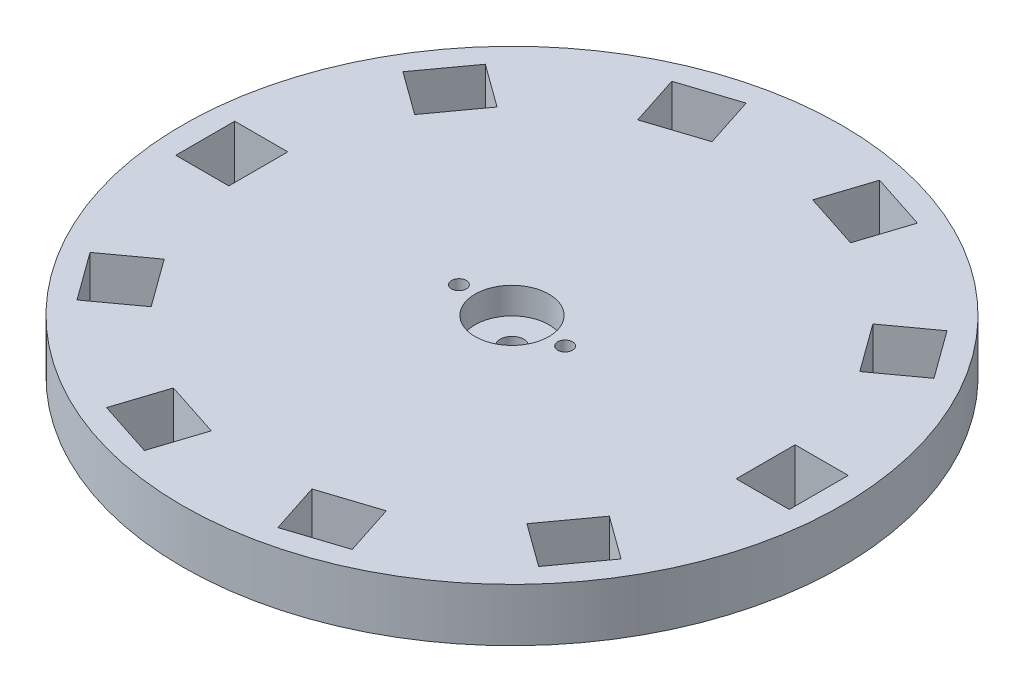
SolidWorks part; units mm, degrees
ref_plane "Front Plane" through (0, 0, 0) normal (0, 0, 1) x (1, 0, 0)
ref_plane "Top Plane" through (0, 0, 0) normal (0, 1, 0) x (1, 0, 0)
ref_plane "Right Plane" through (0, 0, 0) normal (1, 0, 0) x (0, 0, -1)
sketch "Sketch1" plane through (0, 0, 0) normal (0, 1, 0) x (1, 0, 0)
  circle A0 centre (0, 0) radius 111.73
  dimension "D1" = 223.46
extrude "Boss-Extrude1" add sketch "Sketch1" along normal blind 18
sketch "Sketch2" plane through (0, 18, 0) normal (0, 1, 0) x (1, 0, 0)
  circle A0 centre (0, 0) radius 4
  dimension "D1" = 8
extrude "Cut-Extrude1" cut sketch "Sketch2" against normal through all both and the other way through all
sketch "Sketch3" plane through (0, 18, 0) normal (0, 1, 0) x (1, 0, 0)
  circle A0 centre (0, 0) radius 12.5
  dimension "D1" = 25
extrude "Cut-Extrude2" cut sketch "Sketch3" against normal blind 9
sketch "Sketch4" plane through (0, 18, 0) normal (0, 1, 0) x (1, 0, 0)
  line L0 (15.5, 0) -> (-15.5, 0) construction
  line L1 (-15.5, 0) -> (15.5, 0) construction
  line L2 (0, 0) -> (0, -27.2184) construction
  circle A0 centre (18, 0) radius 2.5
  circle A1 centre (-18, 0) radius 2.5
  point P6 (0, 0)
  dimension "D2" = 5
  dimension "D1" = 31
extrude "Cut-Extrude3" cut sketch "Sketch4" against normal through all
sketch "Sketch5" plane through (0, 0, 0) normal (0, -1, 0) x (1, 0, 0)
  line L0 (0, 0) -> (95, 0) construction
  line L1 (104, 20) -> (86, 20) construction
  line L2 (104, 20) -> (104, -20) construction
  line L3 (104, -20) -> (86, -20) construction
  line L4 (86, 20) -> (86, -20) construction
  line L5 (104, 20) -> (86, -20) construction
  line L6 (104, -20) -> (86, 20) construction
  line L7 (90.0156, -53.0395) -> (75.4533, -42.4594)
  line L8 (104, 10) -> (86, 10)
  line L9 (104, 10) -> (104, -10)
  line L10 (104, -10) -> (86, -10)
  line L11 (86, 10) -> (86, -10)
  line L12 (104, 10) -> (86, -10) construction
  line L13 (104, -10) -> (86, 10) construction
  line L14 (90.0156, -53.0395) -> (78.2599, -69.2198)
  line L15 (78.2599, -69.2198) -> (63.6976, -58.6397)
  line L16 (75.4533, -42.4594) -> (63.6976, -58.6397)
  line L17 (95.8935, -44.9493) -> (81.3312, -34.3692) construction
  line L18 (95.8935, -44.9493) -> (72.3821, -77.31) construction
  line L19 (72.3821, -77.31) -> (57.8198, -66.7299) construction
  line L20 (81.3312, -34.3692) -> (57.8198, -66.7299) construction
  line L21 (95.8935, -44.9493) -> (57.8198, -66.7299) construction
  line L22 (72.3821, -77.31) -> (81.3312, -34.3692) construction
  line L23 (90.0156, -53.0395) -> (63.6976, -58.6397) construction
  line L24 (78.2599, -69.2198) -> (75.4533, -42.4594) construction
  line L25 (41.6483, -95.8197) -> (36.086, -78.7007)
  line L26 (41.6483, -95.8197) -> (22.6272, -102)
  line L27 (22.6272, -102) -> (17.0649, -84.881)
  line L28 (36.086, -78.7007) -> (17.0649, -84.881)
  line L29 (51.1589, -92.7295) -> (45.5966, -75.6105) construction
  line L30 (51.1589, -92.7295) -> (13.1166, -105.0902) construction
  line L31 (13.1166, -105.0902) -> (7.5543, -87.9712) construction
  line L32 (45.5966, -75.6105) -> (7.5543, -87.9712) construction
  line L33 (51.1589, -92.7295) -> (7.5543, -87.9712) construction
  line L34 (13.1166, -105.0902) -> (45.5966, -75.6105) construction
  line L35 (41.6483, -95.8197) -> (17.0649, -84.881) construction
  line L36 (22.6272, -102) -> (36.086, -78.7007) construction
  line L37 (-22.6272, -102) -> (-17.0649, -84.881)
  line L38 (-22.6272, -102) -> (-41.6483, -95.8197)
  line L39 (-41.6483, -95.8197) -> (-36.086, -78.7007)
  line L40 (-17.0649, -84.881) -> (-36.086, -78.7007)
  line L41 (-13.1166, -105.0902) -> (-7.5543, -87.9712) construction
  line L42 (-13.1166, -105.0902) -> (-51.1589, -92.7295) construction
  line L43 (-51.1589, -92.7295) -> (-45.5966, -75.6105) construction
  line L44 (-7.5543, -87.9712) -> (-45.5966, -75.6105) construction
  line L45 (-13.1166, -105.0902) -> (-45.5966, -75.6105) construction
  line L46 (-51.1589, -92.7295) -> (-7.5543, -87.9712) construction
  line L47 (-22.6272, -102) -> (-36.086, -78.7007) construction
  line L48 (-41.6483, -95.8197) -> (-17.0649, -84.881) construction
  line L49 (-78.2599, -69.2198) -> (-63.6976, -58.6397)
  line L50 (-78.2599, -69.2198) -> (-90.0156, -53.0395)
  line L51 (-90.0156, -53.0395) -> (-75.4533, -42.4594)
  line L52 (-63.6976, -58.6397) -> (-75.4533, -42.4594)
  line L53 (-72.3821, -77.31) -> (-57.8198, -66.7299) construction
  line L54 (-72.3821, -77.31) -> (-95.8935, -44.9493) construction
  line L55 (-95.8935, -44.9493) -> (-81.3312, -34.3692) construction
  line L56 (-57.8198, -66.7299) -> (-81.3312, -34.3692) construction
  line L57 (-72.3821, -77.31) -> (-81.3312, -34.3692) construction
  line L58 (-95.8935, -44.9493) -> (-57.8198, -66.7299) construction
  line L59 (-78.2599, -69.2198) -> (-75.4533, -42.4594) construction
  line L60 (-90.0156, -53.0395) -> (-63.6976, -58.6397) construction
  line L61 (-104, -10) -> (-86, -10)
  line L62 (-104, -10) -> (-104, 10)
  line L63 (-104, 10) -> (-86, 10)
  line L64 (-86, -10) -> (-86, 10)
  line L65 (-104, -20) -> (-86, -20) construction
  line L66 (-104, -20) -> (-104, 20) construction
  line L67 (-104, 20) -> (-86, 20) construction
  line L68 (-86, -20) -> (-86, 20) construction
  line L69 (-104, -20) -> (-86, 20) construction
  line L70 (-104, 20) -> (-86, -20) construction
  line L71 (-104, -10) -> (-86, 10) construction
  line L72 (-104, 10) -> (-86, -10) construction
  line L73 (-90.0156, 53.0395) -> (-75.4533, 42.4594)
  line L74 (-90.0156, 53.0395) -> (-78.2599, 69.2198)
  line L75 (-78.2599, 69.2198) -> (-63.6976, 58.6397)
  line L76 (-75.4533, 42.4594) -> (-63.6976, 58.6397)
  line L77 (-95.8935, 44.9493) -> (-81.3312, 34.3692) construction
  line L78 (-95.8935, 44.9493) -> (-72.3821, 77.31) construction
  line L79 (-72.3821, 77.31) -> (-57.8198, 66.7299) construction
  line L80 (-81.3312, 34.3692) -> (-57.8198, 66.7299) construction
  line L81 (-95.8935, 44.9493) -> (-57.8198, 66.7299) construction
  line L82 (-72.3821, 77.31) -> (-81.3312, 34.3692) construction
  line L83 (-90.0156, 53.0395) -> (-63.6976, 58.6397) construction
  line L84 (-78.2599, 69.2198) -> (-75.4533, 42.4594) construction
  line L85 (-41.6483, 95.8197) -> (-36.086, 78.7007)
  line L86 (-41.6483, 95.8197) -> (-22.6272, 102)
  line L87 (-22.6272, 102) -> (-17.0649, 84.881)
  line L88 (-36.086, 78.7007) -> (-17.0649, 84.881)
  line L89 (-51.1589, 92.7295) -> (-45.5966, 75.6105) construction
  line L90 (-51.1589, 92.7295) -> (-13.1166, 105.0902) construction
  line L91 (-13.1166, 105.0902) -> (-7.5543, 87.9712) construction
  line L92 (-45.5966, 75.6105) -> (-7.5543, 87.9712) construction
  line L93 (-51.1589, 92.7295) -> (-7.5543, 87.9712) construction
  line L94 (-13.1166, 105.0902) -> (-45.5966, 75.6105) construction
  line L95 (-41.6483, 95.8197) -> (-17.0649, 84.881) construction
  line L96 (-22.6272, 102) -> (-36.086, 78.7007) construction
  line L97 (22.6272, 102) -> (17.0649, 84.881)
  line L98 (22.6272, 102) -> (41.6483, 95.8197)
  line L99 (41.6483, 95.8197) -> (36.086, 78.7007)
  line L100 (17.0649, 84.881) -> (36.086, 78.7007)
  line L101 (13.1166, 105.0902) -> (7.5543, 87.9712) construction
  line L102 (13.1166, 105.0902) -> (51.1589, 92.7295) construction
  line L103 (51.1589, 92.7295) -> (45.5966, 75.6105) construction
  line L104 (7.5543, 87.9712) -> (45.5966, 75.6105) construction
  line L105 (13.1166, 105.0902) -> (45.5966, 75.6105) construction
  line L106 (51.1589, 92.7295) -> (7.5543, 87.9712) construction
  line L107 (22.6272, 102) -> (36.086, 78.7007) construction
  line L108 (41.6483, 95.8197) -> (17.0649, 84.881) construction
  line L109 (78.2599, 69.2198) -> (63.6976, 58.6397)
  line L110 (78.2599, 69.2198) -> (90.0156, 53.0395)
  line L111 (90.0156, 53.0395) -> (75.4533, 42.4594)
  line L112 (63.6976, 58.6397) -> (75.4533, 42.4594)
  line L113 (72.3821, 77.31) -> (57.8198, 66.7299) construction
  line L114 (72.3821, 77.31) -> (95.8935, 44.9493) construction
  line L115 (95.8935, 44.9493) -> (81.3312, 34.3692) construction
  line L116 (57.8198, 66.7299) -> (81.3312, 34.3692) construction
  line L117 (72.3821, 77.31) -> (81.3312, 34.3692) construction
  line L118 (95.8935, 44.9493) -> (57.8198, 66.7299) construction
  line L119 (78.2599, 69.2198) -> (75.4533, 42.4594) construction
  line L120 (90.0156, 53.0395) -> (63.6976, 58.6397) construction
  point P0 (95, 0)
  point P15 (76.8566, -55.8396)
  point P24 (29.3566, -90.3504)
  point P33 (-29.3566, -90.3504)
  point P42 (-76.8566, -55.8396)
  point P51 (-95, 0)
  point P60 (-76.8566, 55.8396)
  point P69 (-29.3566, 90.3504)
  point P78 (29.3566, 90.3504)
  point P87 (76.8566, 55.8396)
  point P123 (0, 0)
  dimension "D1" = 95
  dimension "D2" = 18
  dimension "D3" = 40
  dimension "D4" = 20
  dimension "D5" = 10
extrude "Cut-Extrude4" cut sketch "Sketch5" against normal through all
